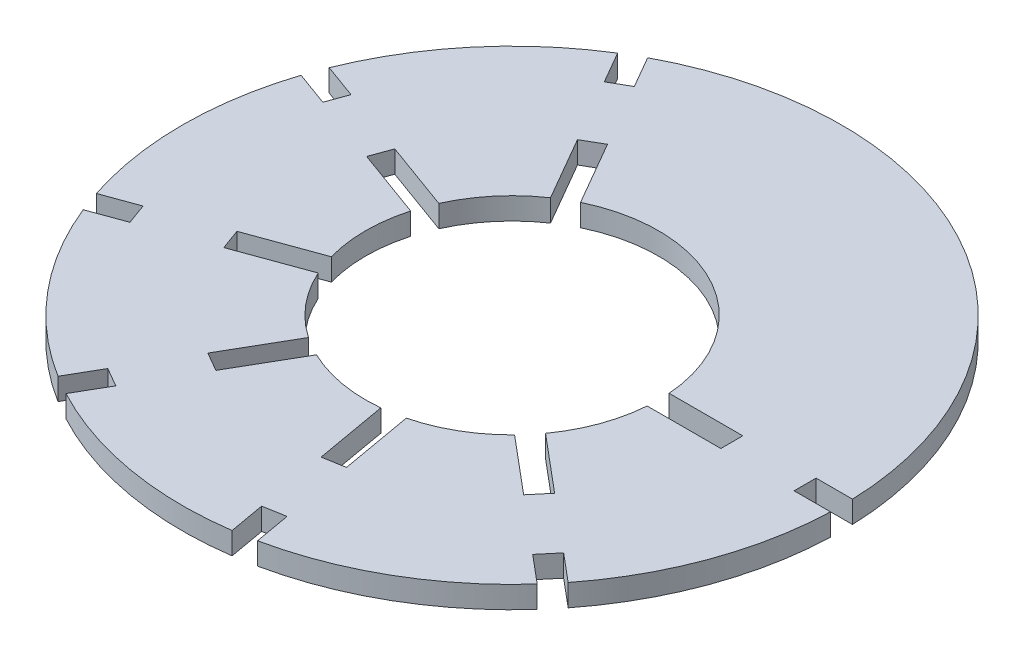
SolidWorks part; units mm, degrees
ref_plane "Front Plane" through (0, 0, 0) normal (0, 0, 1) x (1, 0, 0)
ref_plane "Top Plane" through (0, 0, 0) normal (0, 1, 0) x (1, 0, 0)
ref_plane "Right Plane" through (0, 0, 0) normal (1, 0, 0) x (0, 0, -1)
sketch "Sketch1" plane through (0, 0, 0) normal (0, 1, 0) x (1, 0, 0)
  circle A0 centre (0, 0) radius 225
  circle A1 centre (0, 0) radius 100
extrude "Boss-Extrude1" add sketch "Sketch1" along normal blind 15 contours A0
sketch "Sketch2" plane through (0, 15, 0) normal (0, 1, 0) x (1, 0, 0)
  line L0 (0, 0) -> (225, 0) construction
  line L1 (200, 7.5) -> (250, 7.5)
  line L2 (95, 7.5) -> (150, 7.5)
  line L3 (95, 7.5) -> (95, -7.5)
  line L4 (95, -7.5) -> (150, -7.5)
  line L5 (150, 7.5) -> (150, -7.5)
  line L6 (200, 7.5) -> (200, -7.5)
  line L7 (200, -7.5) -> (250, -7.5)
  line L8 (42.1157, -195.6592) -> (50.7981, -244.8996)
  line L9 (23.8826, -92.2544) -> (33.4333, -146.4188)
  line L10 (23.8826, -92.2544) -> (9.1105, -94.8591)
  line L11 (9.1105, -94.8591) -> (18.6612, -149.0235)
  line L12 (33.4333, -146.4188) -> (18.6612, -149.0235)
  line L13 (42.1157, -195.6592) -> (27.3436, -198.2639)
  line L14 (27.3436, -198.2639) -> (36.026, -247.5043)
  line L15 (158.0298, -122.8122) -> (196.332, -154.9516)
  line L16 (77.5951, -55.3195) -> (119.7276, -90.6728)
  line L17 (77.5951, -55.3195) -> (67.9533, -66.8102)
  line L18 (67.9533, -66.8102) -> (110.0858, -102.1635)
  line L19 (119.7276, -90.6728) -> (110.0858, -102.1635)
  line L20 (158.0298, -122.8122) -> (148.388, -134.3029)
  line L21 (148.388, -134.3029) -> (186.6902, -166.4422)
  line L22 (186.6902, -166.4422) -> (196.332, -154.9516)
  line L23 (0, 0) -> (39.0708, -221.5817) construction
  line L24 (-93.5048, -176.9551) -> (-118.5048, -220.2564)
  line L25 (-41.0048, -86.0224) -> (-68.5048, -133.6538)
  line L26 (-41.0048, -86.0224) -> (-53.9952, -78.5224)
  line L27 (36.026, -247.5043) -> (50.7981, -244.8996)
  line L28 (-131.4952, -212.7564) -> (-118.5048, -220.2564)
  line L29 (0, 0) -> (172.36, -144.6272) construction
  line L30 (-53.9952, -78.5224) -> (-81.4952, -126.1538)
  line L31 (-68.5048, -133.6538) -> (-81.4952, -126.1538)
  line L32 (-93.5048, -176.9551) -> (-106.4952, -169.4551)
  line L33 (-106.4952, -169.4551) -> (-131.4952, -212.7564)
  line L34 (0, 0) -> (-112.5, -194.8557) construction
  line L35 (-185.3734, -75.4517) -> (-232.358, -92.5527)
  line L36 (-86.7056, -39.5396) -> (-138.3887, -58.3507)
  line L37 (-86.7056, -39.5396) -> (-91.836, -25.4442)
  line L38 (-91.836, -25.4442) -> (-143.519, -44.2553)
  line L39 (-138.3887, -58.3507) -> (-143.519, -44.2553)
  line L40 (-185.3734, -75.4517) -> (-190.5037, -61.3563)
  line L41 (-190.5037, -61.3563) -> (-237.4883, -78.4573)
  line L42 (0, 0) -> (-211.4308, -76.9545) construction
  line L43 (-190.5037, 61.3563) -> (-237.4883, 78.4573)
  line L44 (-91.836, 25.4442) -> (-143.519, 44.2553)
  line L45 (-91.836, 25.4442) -> (-86.7056, 39.5396)
  line L46 (-86.7056, 39.5396) -> (-138.3887, 58.3507)
  line L47 (-143.519, 44.2553) -> (-138.3887, 58.3507)
  line L48 (-190.5037, 61.3563) -> (-185.3734, 75.4517)
  line L49 (-185.3734, 75.4517) -> (-232.358, 92.5527)
  line L50 (0, 0) -> (-211.4308, 76.9545) construction
  line L51 (250, -7.5) -> (250, 7.5)
  line L52 (-237.4883, -78.4573) -> (-232.358, -92.5527)
  line L53 (-232.358, 92.5527) -> (-237.4883, 78.4573)
  line L54 (-106.4952, 169.4551) -> (-131.4952, 212.7564)
  line L55 (-53.9952, 78.5224) -> (-81.4952, 126.1538)
  line L56 (-53.9952, 78.5224) -> (-41.0048, 86.0224)
  line L57 (-41.0048, 86.0224) -> (-68.5048, 133.6538)
  line L58 (-81.4952, 126.1538) -> (-68.5048, 133.6538)
  line L59 (-106.4952, 169.4551) -> (-93.5048, 176.9551)
  line L60 (-93.5048, 176.9551) -> (-118.5048, 220.2564)
  line L61 (0, 0) -> (-112.5, 194.8557) construction
  line L62 (-118.5048, 220.2564) -> (-131.4952, 212.7564)
  circle A0 centre (0, 0) radius 225 construction
  point P13 (-12.0777, 27.2748)
extrude "Cut-Extrude3" cut sketch "Sketch2" against normal blind 15 contours L7 L51 L1 L6 | L4 L5 L2 L3 | L21 L22 L15 L20 | L18 L19 L16 L17 | L8 L27 L14 L13 | L9 L12 L11 L10 | L25 L31 L30 L26 | L24 L28 L33 L32 | L35 L52 L41 L40 | L36 L39 L38 L37 | L44 L47 L46 L45 | L43 L53 L49 L48 | L55 L58 L57 L56 | L54 L62 L60 L59
equation "\"InnerRadius\"= 100mm"
equation "\"D2@Sketch1\"= \"InnerRadius\""
equation "\"D1@Sketch1\"=\"InnerRadius\"+125"
equation "\"D4@Sketch2\"= \"InnerRadius\"-5"
